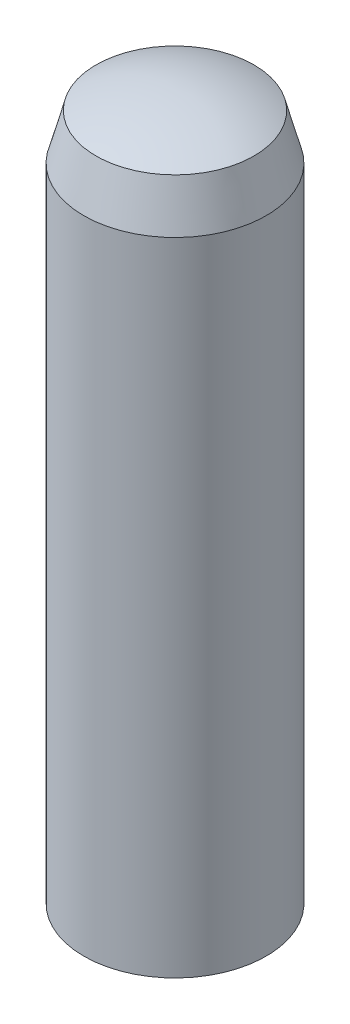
SolidWorks part; units mm, degrees
ref_plane "XY" through (0, 0, 0) normal (0, 0, 1) x (1, 0, 0)
ref_plane "XZ" through (0, 0, 0) normal (0, 1, 0) x (1, 0, 0)
ref_plane "YZ" through (0, 0, 0) normal (1, 0, 0) x (0, 0, -1)
sketch "Esquisse1" plane through (0, 0, 0) normal (0, 0, 1) x (1, 0, 0)
  line L0 (0, 0) -> (0, 58.0744) construction
  line L1 (-3, 0.8038) -> (-3, 21.9)
  line L2 (-3, 21.9) -> (-2.5981, 23.4)
  line L3 (0, 0) -> (0, 24)
  arc A0 (0, 0) -> (-3, 0.8038) centre (0, 6) cw
  arc A1 (-2.5981, 23.4) -> (0, 24) centre (0, 18.075) cw
  dimension "R" = 6
  dimension "d_m6" = 3
  dimension "D4" = 15
  dimension "L2" = 1.5
  dimension "L" = 24
  dimension "b" = 0.6
revolve "Base-Révolution" add sketch "Esquisse1" angle 360 about L0
